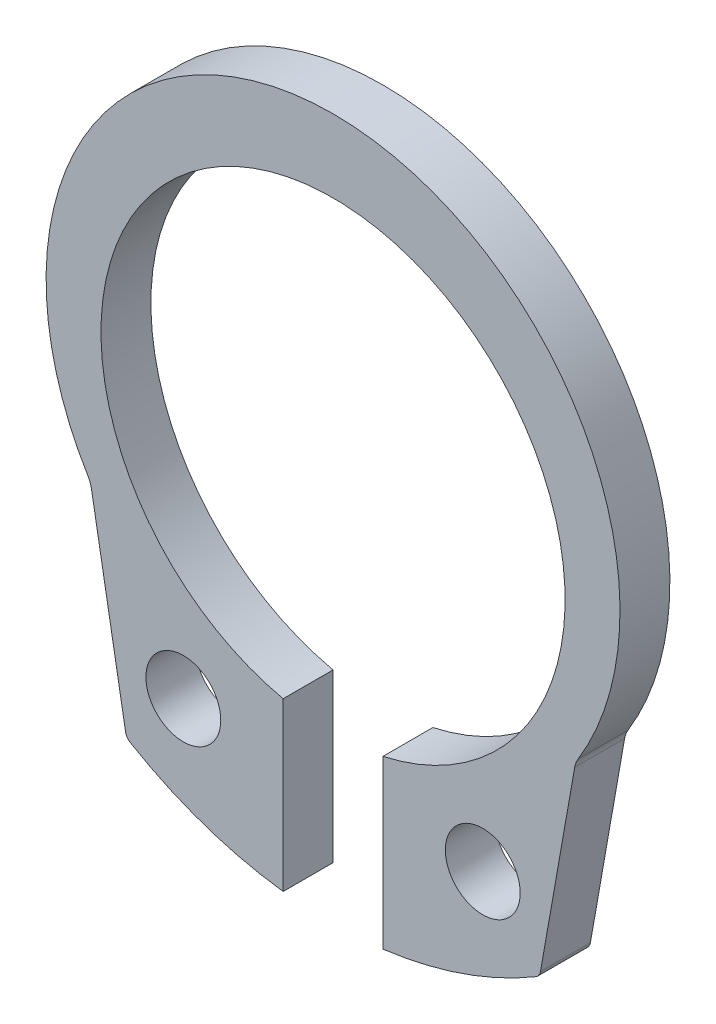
SolidWorks part; units mm, degrees
ref_plane "Front" through (0, 0, 0) normal (0, 0, 1) x (1, 0, 0)
ref_plane "Top" through (0, 0, 0) normal (0, 1, 0) x (1, 0, 0)
ref_plane "Right" through (0, 0, 0) normal (1, 0, 0) x (0, 0, -1)
other "Configuration Table"
sketch "Sketch1" plane through (0, 0, 0) normal (0, 0, 1) x (1, 0, 0)
  line L0 (0, 4.2365) -> (0, -4.9012) construction
  line L1 (-1, -4.9012) -> (-1, -8.2469)
  line L2 (1, -4.9012) -> (1, -8.2469)
  line L3 (6.3, -0.36) -> (-6.3, -0.36) construction
  line L4 (4.859, -3.0745) -> (4.141, -7.1463)
  line L7 (-4.859, -3.0745) -> (-4.141, -7.1463)
  line L8 (-4.859, -3.0745) -> (-4.859, -11.1453) construction
  arc A0 (1, -4.9012) -> (-1, -4.9012) centre (0, -0.36) ccw
  arc A1 (4.859, -3.0745) -> (-4.859, -3.0745) centre (0, 0) ccw
  arc A2 (-6.3, -0.36) -> (6.3, -0.36) centre (0, -0.36) ccw construction
  arc A3 (4.141, -7.1463) -> (1, -8.2469) centre (0, -0.36) cw
  arc A4 (-4.141, -7.1463) -> (-1, -8.2469) centre (0, -0.36) ccw
  circle A5 centre (3, -5.8999) radius 0.75
  circle A6 centre (-3, -5.8999) radius 0.75
  point P17 (-4.5, -5.1104)
  dimension "d" = 9.3
  dimension "D2" = 10
  dimension "d0" = 11.5
  dimension "d1" = 1.5
  dimension "R1" = 6.3
  dimension "R" = 7.95
  dimension "B1" = 2
  dimension "C" = 0.36
  dimension "L" = 9
  dimension "B2" = 6
extrude "Body" add sketch "Sketch1" against normal blind 1
fillet "Fillet1" radius 0.2 2 edges at (-4.141, -7.1463, -0.5) (4.141, -7.1463, -0.5)
fillet "Fillet2" radius 0.5 2 edges at (4.859, -3.0745, -0.5) (-4.859, -3.0745, -0.5)
